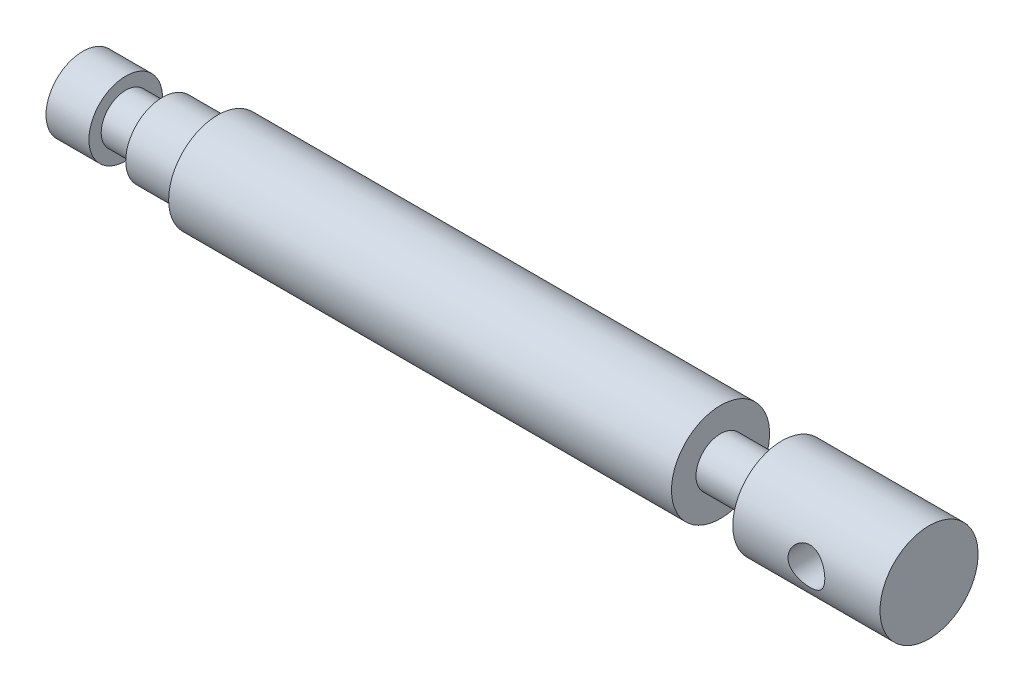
SolidWorks part; units mm, degrees
ref_plane "Front Plane" through (0, 0, 0) normal (0, 0, 1) x (1, 0, 0)
ref_plane "Top Plane" through (0, 0, 0) normal (0, 1, 0) x (1, 0, 0)
ref_plane "Right Plane" through (0, 0, 0) normal (1, 0, 0) x (0, 0, -1)
sketch "Sketch1" plane through (0, 0, 0) normal (0, 0, 1) x (1, 0, 0)
  line L0 (0, 0) -> (179.7348, 0) construction
  line L1 (0, 0) -> (0, 6)
  line L2 (0, 6) -> (7, 6)
  line L3 (7, 6) -> (7, 4)
  line L4 (7, 4) -> (13, 4)
  line L5 (13, 4) -> (13, 6)
  line L6 (13, 6) -> (22, 6)
  line L7 (22, 6) -> (22, 8)
  line L8 (22, 8) -> (104, 8)
  line L9 (104, 8) -> (104, 4)
  line L10 (104, 4) -> (114, 4)
  line L11 (114, 4) -> (114, 8)
  line L12 (114, 8) -> (138, 8)
  line L13 (138, 8) -> (138, 0)
  line L14 (138, 0) -> (0, 0)
  dimension "D1" = 138
  dimension "D2" = 8
  dimension "D3" = 12
  dimension "D4" = 6
  dimension "D5" = 82
  dimension "D6" = 10
  dimension "D7" = 24
  dimension "D8" = 7
  dimension "D9" = 16
revolve "Revolve1" add sketch "Sketch1" angle 360 about L0
sketch "Sketch2" plane through (0, 0, 0) normal (0, 0, 1) x (1, 0, 0)
  line L0 (138, 8) -> (114, 8) construction
  circle A0 centre (126, 0) radius 3
  dimension "D1" = 6
  dimension "D2" = 12
  dimension "D3" = 8
extrude "Extrude1" cut sketch "Sketch2" against normal mid plane 30
